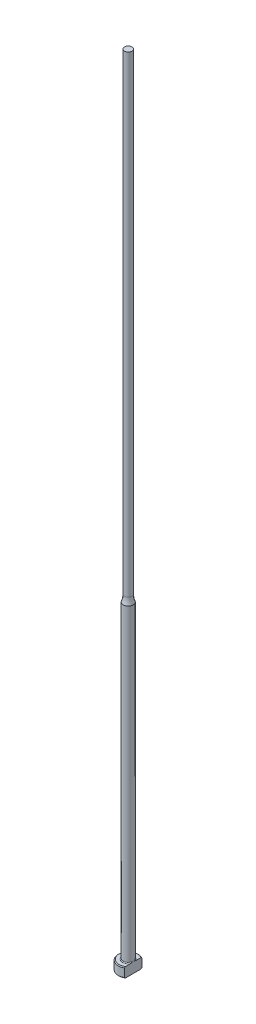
SolidWorks part; units mm, degrees
ref_plane "Front Plane" through (0, 0, 0) normal (0, 0, 1) x (1, 0, 0)
ref_plane "Top Plane" through (0, 0, 0) normal (0, 1, 0) x (1, 0, 0)
ref_plane "Right Plane" through (0, 0, 0) normal (1, 0, 0) x (0, 0, -1)
sketch "Sketch1" plane through (0, 0, 0) normal (0, 0, 1) x (1, 0, 0)
  line L0 (0, 259.9588) -> (0, -15.1925) construction
  line L1 (0, 0) -> (-3.175, 0)
  line L2 (-3.175, 0) -> (-3.175, 3.175)
  line L3 (-3.175, 3.175) -> (-1.5875, 3.175)
  line L4 (-1.19, 103.8114) -> (-1.19, 254)
  line L5 (-1.19, 254) -> (0, 254)
  line L6 (0, 254) -> (0, 0)
  line L7 (-1.5875, 3.175) -> (-1.5875, 101.6)
  arc A0 (-1.5875, 101.6) -> (-1.19, 103.8114) centre (-7.54, 103.8114) ccw
  point P13 (-1.5875, 0)
  dimension "D1" = 6.35
  dimension "L" = 254
  dimension "D2" = 3.175
  dimension "H" = 6.35
  dimension "T" = 3.175
  dimension "D" = 2.38
  dimension "S" = 101.6
revolve "Revolve1" add sketch "Sketch1" angle 360 about L0
chamfer "Chamfer1" distance 0.254 angle 45 2 edges at (0, 3.175, 3.175) (0, 0, 3.175)
fillet "Fillet1" radius 0.254 1 edges at (0, 3.175, 1.5875)
sketch "Sketch2" plane through (0, 0, 0) normal (0, 1, 0) x (1, 0, 0)
  line L0 (1.5875, -2.7496) -> (1.5875, 2.7496)
  circle A0 centre (0, 0) radius 3.175 construction
  arc A2 (1.5875, -2.7496) -> (1.5875, 2.7496) centre (0, 0) ccw
  circle A3 centre (0, 0) radius 3.175 construction
  circle A4 centre (0, 0) radius 1.5875 construction
extrude "Key Head" cut sketch "Sketch2" along normal up to next
